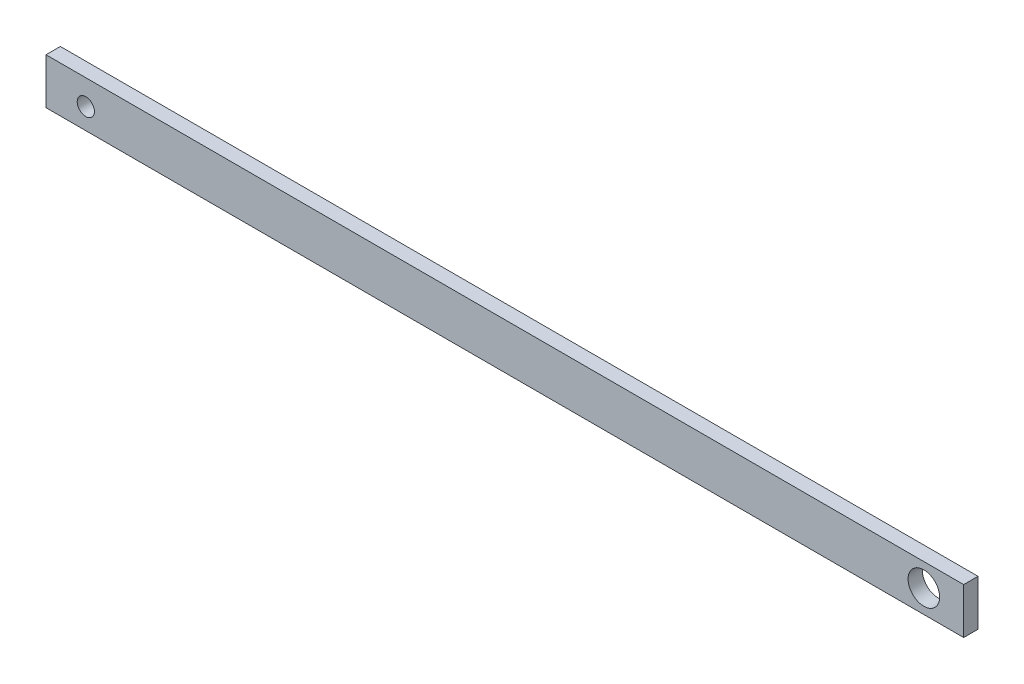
SolidWorks part; units mm, degrees
ref_plane "Front Plane" through (0, 0, 0) normal (0, 0, 1) x (1, 0, 0)
ref_plane "Top Plane" through (0, 0, 0) normal (0, 1, 0) x (1, 0, 0)
ref_plane "Right Plane" through (0, 0, 0) normal (1, 0, 0) x (0, 0, -1)
sketch "Sketch1" plane through (0, 0, 0) normal (0, 0, 1) x (1, 0, 0)
  line L1 (0, 0) -> (160, 0)
  line L2 (0, 0) -> (0, 8)
  line L3 (0, 8) -> (160, 8)
  line L4 (160, 0) -> (160, 8)
  dimension "D1" = 160
  dimension "D2" = 8
extrude "Boss-Extrude1" add sketch "Sketch1" along normal blind 2.5
sketch "Sketch2" plane through (0, 0, 2.5) normal (0, 0, 1) x (1, 0, 0)
  line L0 (160, 8) -> (0, 8) construction
  line L1 (160, 0) -> (160, 8) construction
  circle A0 centre (6.94, 3.6335) radius 1.5
  circle A1 centre (153.06, 4) radius 2.75
  dimension "D1" = 5.5
  dimension "D4" = 3
  dimension "D2" = 4
  dimension "D3" = 146.12
  dimension "D5" = 6.94
extrude "Cut-Extrude1" cut sketch "Sketch2" against normal blind 2.5
